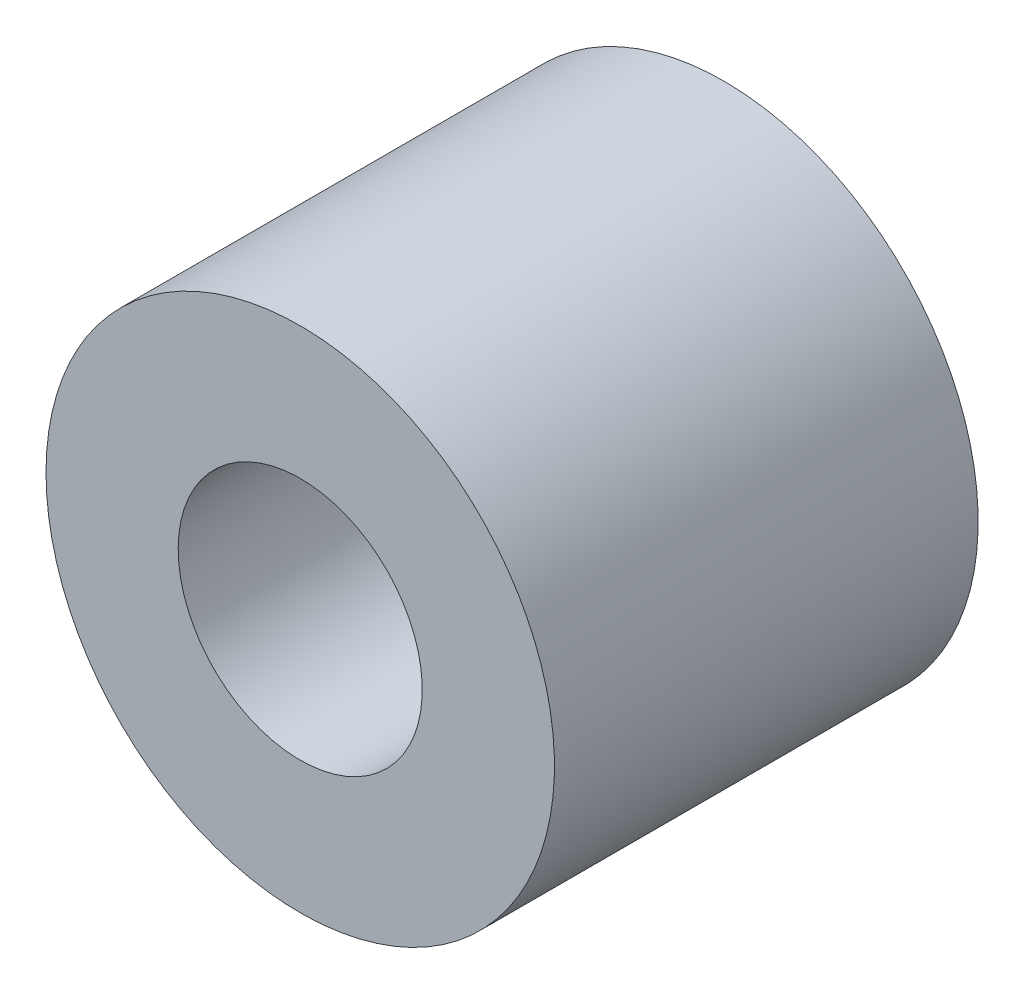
SolidWorks part; units mm, degrees
ref_plane "Front Plane" through (0, 0, 0) normal (0, 0, 1) x (1, 0, 0)
ref_plane "Top Plane" through (0, 0, 0) normal (0, 1, 0) x (1, 0, 0)
ref_plane "Right Plane" through (0, 0, 0) normal (1, 0, 0) x (0, 0, -1)
ref_plane "Plane1" through (0, 0, 0) normal (0, 0, -1) x (-1, 0, 0)
sketch "Sketch1" plane through (0, 0, 0) normal (0, 0, -1) x (-1, 0, 0)
  circle A0 centre (0, 0) radius 2.3813
  dimension "D1" = 4.7625
extrude "Extrude1" add sketch "Sketch1" along normal blind 3.9688
sketch "Sketch2" plane through (0, 0, -3.9688) normal (0, 0, -1) x (-1, 0, 0)
  circle A0 centre (0, 0) radius 1.143
  dimension "D1" = 2.286
extrude "Cut-Extrude1" cut sketch "Sketch2" against normal through all
